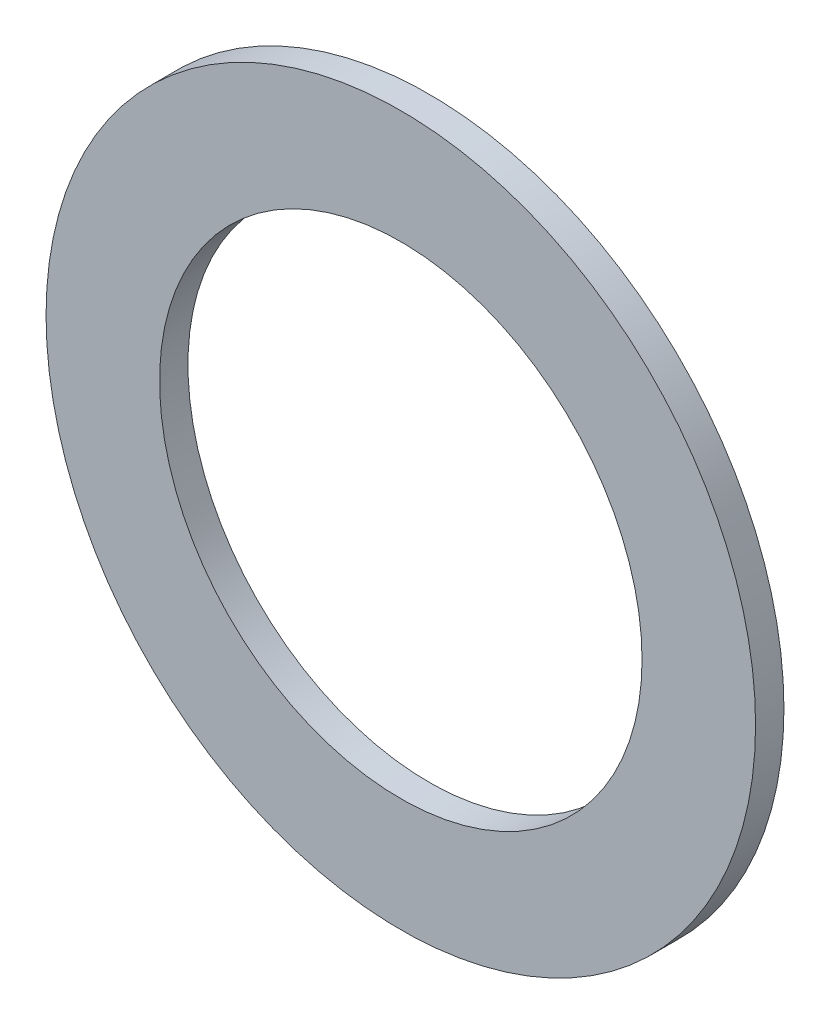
SolidWorks part; units mm, degrees
ref_plane "Plane1" through (0, 0, 0) normal (0, 0, 1) x (1, 0, 0)
ref_plane "Plane2" through (0, 0, 0) normal (0, 1, 0) x (1, 0, 0)
ref_plane "Plane3" through (0, 0, 0) normal (1, 0, 0) x (0, 0, -1)
sketch "Esquisse1" plane through (0, 0, 0) normal (0, 0, 1) x (1, 0, 0)
  circle A0 centre (0, 0) radius 25
  circle A1 centre (0, 0) radius 17
  dimension "D1" = 50
  dimension "D2" = 34
extrude "Base-Extrusion" add sketch "Esquisse1" along normal blind 2
